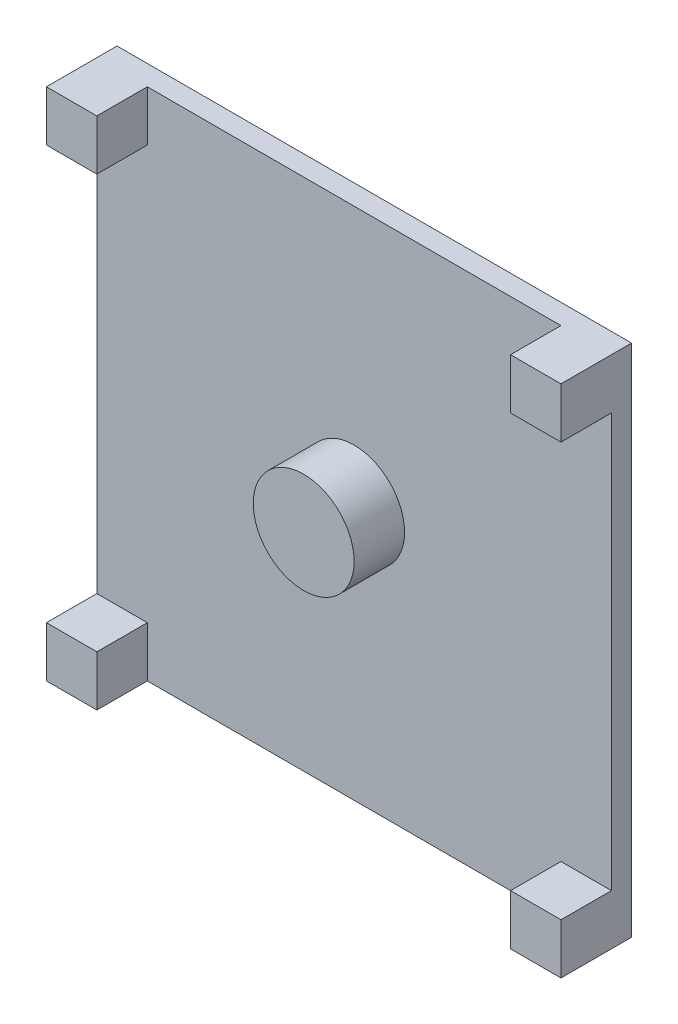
SolidWorks part; units mm, degrees
ref_plane "Plan de face" through (0, 0, 0) normal (0, 0, 1) x (1, 0, 0)
ref_plane "Plan de dessus" through (0, 0, 0) normal (0, 1, 0) x (1, 0, 0)
ref_plane "Plan de droite" through (0, 0, 0) normal (1, 0, 0) x (0, 0, -1)
sketch "Esquisse1" plane through (0, 0, 0) normal (0, 0, 1) x (1, 0, 0)
  line L1 (-45.6212, 33.8819) -> (464.3788, 33.8819)
  line L2 (-45.6212, 33.8819) -> (-45.6212, -476.1181)
  line L3 (-45.6212, -476.1181) -> (464.3788, -476.1181)
  line L4 (464.3788, 33.8819) -> (464.3788, -476.1181)
  dimension "D1" = 510
  dimension "D2" = 510
extrude "Extrusion1" add sketch "Esquisse1" along normal blind 20
sketch "Esquisse2" plane through (0, 0, 20) normal (0, 0, 1) x (1, 0, 0)
  line L0 (-45.6212, 33.8819) -> (464.3788, -476.1181) construction
  line L1 (-45.6212, 33.8819) -> (4.3788, 33.8819)
  line L2 (-45.6212, 33.8819) -> (-45.6212, -16.1181)
  line L3 (-45.6212, -16.1181) -> (4.3788, -16.1181)
  line L4 (4.3788, 33.8819) -> (4.3788, -16.1181)
  line L5 (464.3788, 33.8819) -> (414.3788, 33.8819)
  line L6 (464.3788, 33.8819) -> (464.3788, -16.1181)
  line L7 (464.3788, -16.1181) -> (414.3788, -16.1181)
  line L8 (414.3788, 33.8819) -> (414.3788, -16.1181)
  line L9 (-45.6212, -476.1181) -> (4.3788, -476.1181)
  line L10 (-45.6212, -476.1181) -> (-45.6212, -426.1181)
  line L11 (-45.6212, -426.1181) -> (4.3788, -426.1181)
  line L12 (4.3788, -476.1181) -> (4.3788, -426.1181)
  line L13 (464.3788, -476.1181) -> (414.3788, -476.1181)
  line L14 (464.3788, -476.1181) -> (464.3788, -426.1181)
  line L15 (464.3788, -426.1181) -> (414.3788, -426.1181)
  line L16 (414.3788, -476.1181) -> (414.3788, -426.1181)
  circle A0 centre (209.3788, -221.1181) radius 50
  dimension "D8" = 100
  dimension "D1" = 50
  dimension "D2" = 50
  dimension "D3" = 50
  dimension "D4" = 50
  dimension "D5" = 50
  dimension "D6" = 50
  dimension "D7" = 50
extrude "Boss.-Extru.1" add sketch "Esquisse2" along normal blind 50
